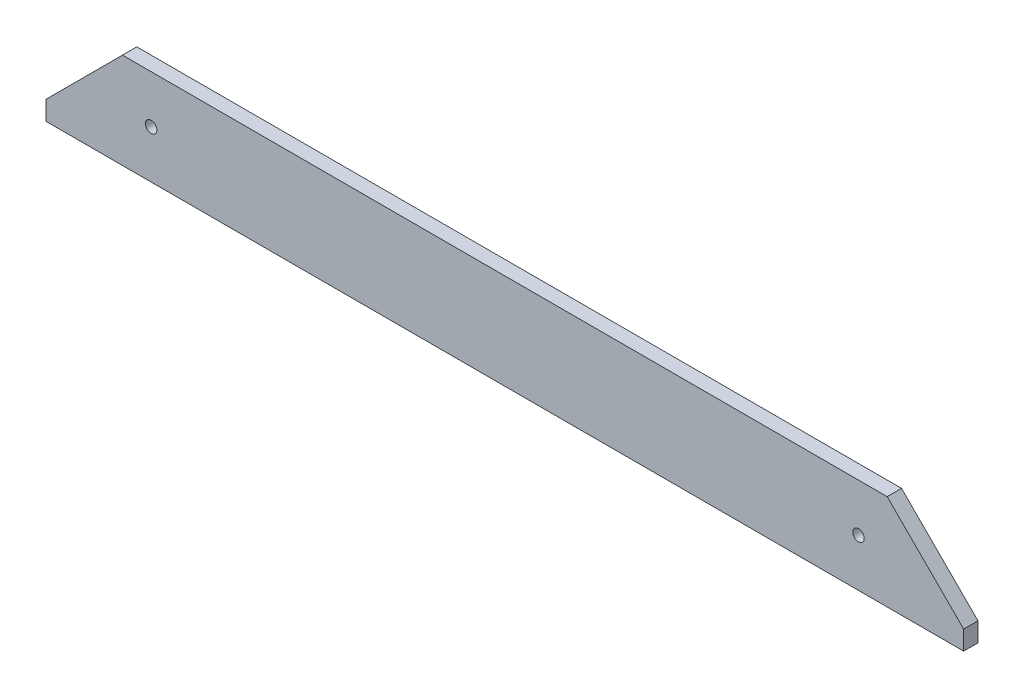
SolidWorks part; units mm, degrees
ref_plane "Front Plane" through (0, 0, 0) normal (0, 0, 1) x (1, 0, 0)
ref_plane "Top Plane" through (0, 0, 0) normal (0, 1, 0) x (1, 0, 0)
ref_plane "Right Plane" through (0, 0, 0) normal (1, 0, 0) x (0, 0, -1)
sketch "Sketch1" plane through (0, 0, 0) normal (0, 0, 1) x (1, 0, 0)
  line L1 (-304.8, -31.75) -> (304.8, -31.75)
  line L2 (-304.8, -31.75) -> (-304.8, 31.75)
  line L3 (-304.8, 31.75) -> (304.8, 31.75)
  line L4 (304.8, -31.75) -> (304.8, 31.75)
  dimension "D1" = 609.6
  dimension "D2" = 63.5
  dimension "D3" = 31.75
  dimension "D4" = 304.8
extrude "Extrude1" add sketch "Sketch1" along normal mid plane 9.525
sketch "Sketch2" plane through (0, 0, 4.7625) normal (0, 0, 1) x (1, 0, 0)
  line L0 (-304.8, -31.75) -> (304.8, -31.75) construction
  circle A0 centre (-234.95, 0) radius 3.81
  circle A1 centre (234.95, 0) radius 3.81
  dimension "D1" = 7.62
  dimension "D2" = 234.95
  dimension "D3" = 234.95
  dimension "D4" = 31.75
extrude "Cut-Extrude1" cut sketch "Sketch2" against normal through all
chamfer "Chamfer1" distance 50.8 angle 45 1 edges at (304.8, 31.75, 0)
chamfer "Chamfer2" distance 50.8 angle 45 1 edges at (-304.8, 31.75, 0)
